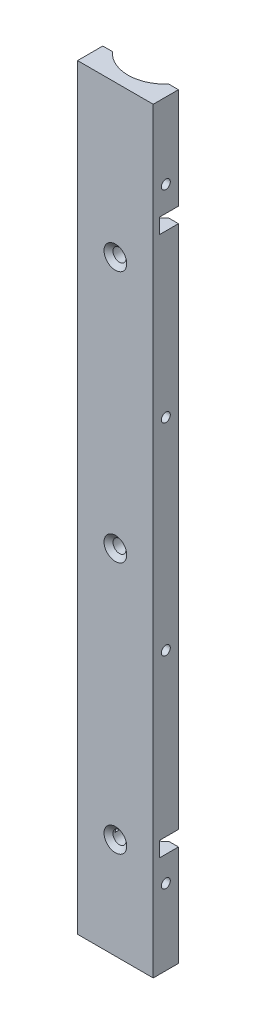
SolidWorks part; units mm, degrees
ref_plane "Front Plane" through (0, 0, 0) normal (0, 0, 1) x (1, 0, 0)
ref_plane "Top Plane" through (0, 0, 0) normal (0, 1, 0) x (1, 0, 0)
ref_plane "Right Plane" through (0, 0, 0) normal (1, 0, 0) x (0, 0, -1)
sketch "Sketch1" plane through (0, 0, 0) normal (0, 1, 0) x (1, 0, 0)
  line L0 (-9.525, 12.7) -> (-9.525, 0)
  line L1 (-9.525, 0) -> (9.525, 0)
  line L2 (9.525, 0) -> (9.525, 12.7)
  line L3 (-9.525, 6.35) -> (9.525, 6.35)
  arc A0 (-9.525, 12.7) -> (9.525, 12.7) centre (0, 12.7) ccw
  dimension "D1" = 19.05
  dimension "D2" = 12.7
  dimension "D3" = 6.35
extrude "Boss-Extrude1" add sketch "Sketch1" along normal blind 190.5 contours A0 L3 L0 L1 L2
hole_wizard "CSK for #4 Flat Head Machine Screw (100)1" positions "Sketch3" profile "Sketch2" countersink size "#4" standard "ANSI Inch"
sketch "Sketch3" plane through (0, 0, 0) normal (0, 0, 1) x (1, 0, 0)
  line L0 (0, 0) -> (0, 25.4) construction
  line L1 (0, 25.4) -> (0, 88.9) construction
  line L2 (0, 88.9) -> (0, 152.4) construction
  point P2 (0, 25.4)
  point P4 (0, 88.9)
  point P6 (0, 152.4)
  dimension "D1" = 63.5
  dimension "D2" = 25.4
sketch "Sketch2" plane through (0, 25.4, 0) normal (1, 0, 0) x (0, -1, 0)
  line L0 (0, 0) -> (0, 26.3806)
  line L1 (0, 26.3806) -> (1.6319, 25.4)
  line L2 (1.6319, 25.4) -> (1.6319, 1.0284)
  line L3 (1.6319, 1.0284) -> (2.8575, 0)
  line L5 (2.8575, 0) -> (0, 0)
  line L6 (-1.6319, 1.0284) -> (-2.8575, 0) construction
  line L10 (0, 26.3806) -> (-1.632, 25.4) construction
  line L11 (0, -6.35) -> (0, 107.95) construction
  dimension "Hole Dia." = 3.2639
  dimension "Hole Depth" = 25.4
  dimension "Near C'Sink Dia." = 5.715
  dimension "Near C'Sink Angle" = 100
  dimension "Drill Angle" = 118
sketch "Sketch4" plane through (0, 0, 0) normal (1, 0, 0) x (0, 0, -1)
  line L0 (6.35, 190.5) -> (6.35, 0) construction
  line L1 (6.35, 165.1) -> (1.5875, 165.1)
  line L2 (6.35, 165.1) -> (6.35, 161.29)
  line L3 (6.35, 161.29) -> (1.5875, 161.29)
  line L4 (1.5875, 165.1) -> (1.5875, 161.29)
  line L5 (1.5875, 165.1) -> (1.5875, 190.5) construction
  line L6 (6.35, 25.4) -> (1.5875, 25.4)
  line L7 (6.35, 25.4) -> (6.35, 29.21)
  line L8 (6.35, 29.21) -> (1.5875, 29.21)
  line L9 (1.5875, 25.4) -> (1.5875, 29.21)
  line L10 (0, 190.5) -> (6.35, 190.5) construction
  line L11 (1.5875, 25.4) -> (1.5875, 0) construction
  line L12 (0, 0) -> (6.35, 0) construction
  dimension "D1" = 3.81
  dimension "D2" = 4.7625
  dimension "D3" = 25.4
extrude "Cut-Extrude1" cut sketch "Sketch4" against normal through all both and the other way through all
sketch "Sketch5" plane through (9.525, 0, 0) normal (1, 0, 0) x (0, 0, -1)
  line L0 (3.175, 190.5) -> (3.175, 171.45) construction
  line L2 (3.175, 171.45) -> (3.175, 120.65) construction
  line L3 (3.175, 120.65) -> (3.175, 69.85) construction
  line L4 (3.175, 69.85) -> (3.175, 19.05) construction
  line L5 (3.175, 19.05) -> (3.175, 0) construction
  line L6 (0, 0) -> (6.35, 0) construction
  dimension "D1" = 152.4
hole_wizard "#4-40 Tapped Hole1" positions "Sketch7" profile "Sketch6" tap size "#4-40" standard "ANSI Inch"
sketch "Sketch7" plane through (9.525, 0, 0) normal (1, 0, 0) x (0, 0, -1)
  point P1 (3.175, 171.45)
  point P4 (3.175, 120.65)
  point P7 (3.175, 69.85)
  point P10 (3.175, 19.05)
sketch "Sketch6" plane through (9.525, 171.45, -3.175) normal (0, 1, 0) x (0, 0, -1)
  line L0 (0, 0) -> (0, 9.0612)
  line L1 (0, 9.0612) -> (1.1303, 8.382)
  line L2 (1.1303, 8.382) -> (1.1303, 0)
  line L5 (1.1303, 0) -> (0, 0)
  line L10 (0, 9.0612) -> (-1.1303, 8.382) construction
  line L11 (0, -6.35) -> (0, 107.95) construction
  dimension "Tap Drill Dia." = 2.2606
  dimension "Tap Drill Depth" = 8.382
  dimension "Drill Angle" = 118
mirror "Mirror1" about plane through (0, 0, 0) normal (1, 0, 0) of "#4-40 Tapped Hole1"
